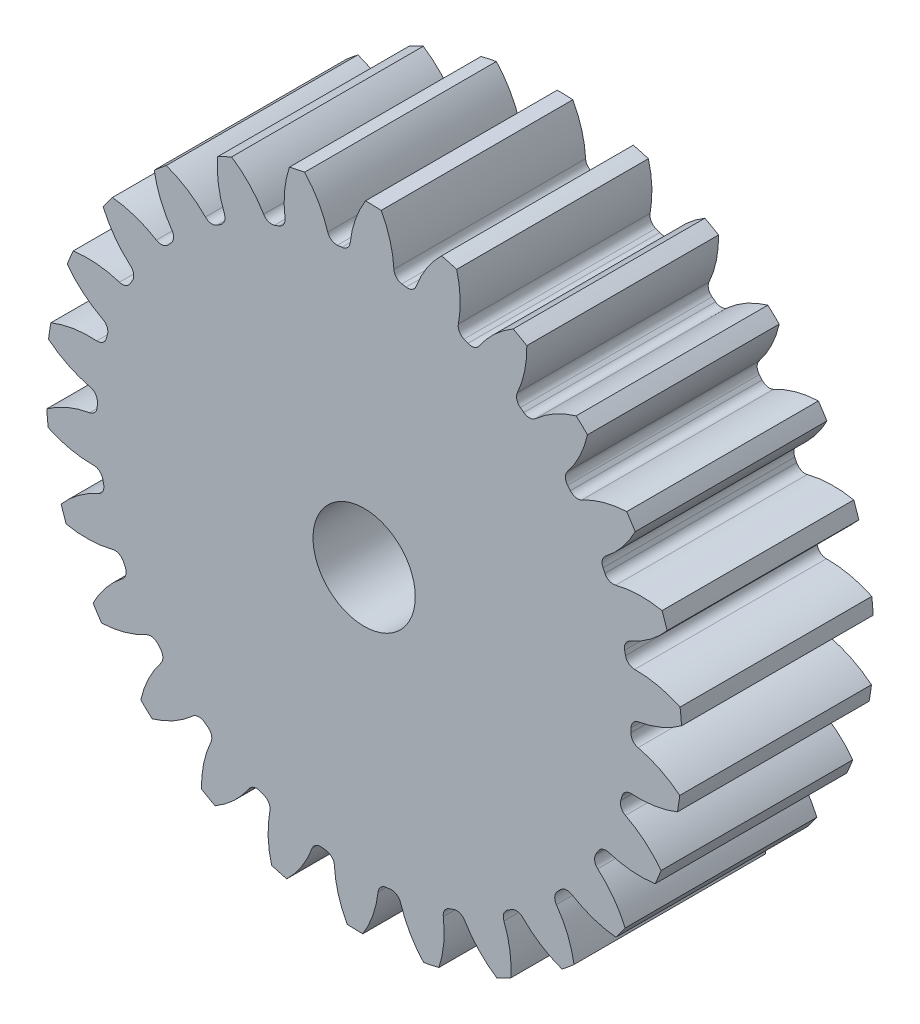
SolidWorks part; units mm, degrees
ref_plane "Front" through (0, 0, 0) normal (0, 0, 1) x (1, 0, 0)
ref_plane "Top" through (0, 0, 0) normal (0, 1, 0) x (1, 0, 0)
ref_plane "Right" through (0, 0, 0) normal (1, 0, 0) x (0, 0, -1)
sketch "Sketch3" plane through (0, 0, 0) normal (0, 0, 1) x (1, 0, 0)
  circle A0 centre (0, 0) radius 158.0444
  dimension "od" = 316.0889
extrude "gearBody" add sketch "Sketch3" along normal blind 95.25
sketch "Sketch2" plane through (0, 0, 0) normal (0, 0, 1) x (1, 0, 0)
  line L0 (0, 0) -> (127.4077, 52.774) construction
  line L1 (157.1505, -20.0086) -> (0, 0) construction
  line L2 (0, 0) -> (36.3143, 0) construction
  line L3 (146.6837, 4.5933) -> (146.1727, -13.0664) construction
  line L5 (146.4282, -4.2365) -> (0, 0) construction
  line L7 (0, 0) -> (137.9051, 0) construction
  arc A0 (137.8913, 1.9505) -> (137.5479, -9.9196) centre (0, 0) ccw construction
  arc A1 (157.6866, 10.6298) -> (156.8082, -19.7289) centre (0, 0) ccw construction
  arc A2 (146.6837, 4.5933) -> (146.1727, -13.0664) centre (0, 0) ccw construction
  arc A3 (132.5535, -4.9104) -> (132.6157, -2.7616) centre (0, 0) ccw
  arc A4 (157.1505, -20.0086) -> (136.0874, -9.5517) centre (124.1434, -60.052) ccw
  arc A5 (157.1505, -20.0086) -> (158.0444, 10.8893) centre (0, 0) ccw
  arc A6 (158.0444, 10.8893) -> (136.412, 1.6676) centre (127.4077, 52.774) cw
  arc A7 (132.6157, -2.7616) -> (136.412, 1.6676) centre (137.2093, -2.8573) cw
  arc A8 (136.0874, -9.5517) -> (132.5535, -4.9104) centre (137.145, -5.0805) cw
  point P6 (158.0444, 10.8893)
  point P22 (157.1505, -20.0086)
  dimension "baseDia" = 275.8102
  dimension "od" = 316.0889
  dimension "pd" = 293.5111
  dimension "rd" = 265.2889
  dimension "rFillet" = 4.5946
  dimension "pointX" = 158.0444
  dimension "pointY" = 10.8893
  dimension "CTT" = 17.6597
  dimension "flankCenterAngle" = 22.5
extrude "toothCut" cut sketch "Sketch2" along normal through all
pattern_circular "CirPattern1" count 26 over 360 about axis through (0, 0, 0) along (0, 0, 1) of "toothCut"
sketch "hub1Dia" plane through (0, 0, 0) normal (0, 0, -1) x (-1, 0, 0)
  circle A0 centre (0, 0) radius 12.7
  dimension "hub1Dia" = 25.4
sketch "hub2Dia" plane through (0, 0, 95.25) normal (0, 0, 1) x (1, 0, 0)
  circle A0 centre (0, 0) radius 12.7
  dimension "hub2dia" = 25.4
sketch "boreDia" plane through (0, 0, 0) normal (0, 0, 1) x (1, 0, 0)
  circle A0 centre (0, 0) radius 25.4
  dimension "boreDia" = 50.8
extrude "bore" cut sketch "boreDia" against normal mid plane 25400
